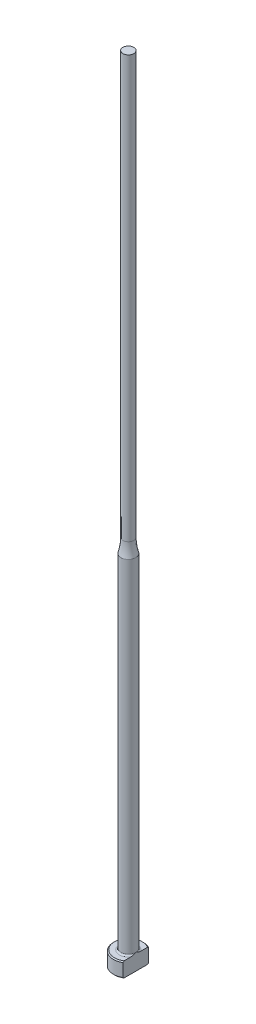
SolidWorks part; units mm, degrees
ref_plane "Front Plane" through (0, 0, 0) normal (0, 0, 1) x (1, 0, 0)
ref_plane "Top Plane" through (0, 0, 0) normal (0, 1, 0) x (1, 0, 0)
ref_plane "Right Plane" through (0, 0, 0) normal (1, 0, 0) x (0, 0, -1)
sketch "Sketch1" plane through (0, 0, 0) normal (0, 0, 1) x (1, 0, 0)
  line L0 (0, 259.9588) -> (0, -15.1925) construction
  line L1 (0, 0) -> (-3, 0)
  line L2 (-3, 0) -> (-3, 3)
  line L3 (-3, 3) -> (-1.5, 3)
  line L4 (-1.1, 75) -> (-1.1, 160)
  line L5 (-1.1, 160) -> (0, 160)
  line L6 (0, 160) -> (0, 0)
  line L7 (-1.5, 3) -> (-1.5, 72.2)
  arc A0 (-1.5, 72.2) -> (-1.1, 75) centre (-11.1, 75) ccw
  point P13 (-1.5, 0)
  dimension "D1" = 10
  dimension "L" = 160
  dimension "H" = 6
  dimension "T" = 3
  dimension "D" = 2.2
  dimension "B" = 3
  dimension "S" = 75
revolve "Revolve1" add sketch "Sketch1" angle 360 about L0
chamfer "Chamfer1" distance 0.2 angle 45 2 edges at (0, 3, 3) (0, 0, 3)
fillet "Fillet1" radius 0.3 1 edges at (0, 3, 1.5)
sketch "Sketch2" plane through (0, 0, 0) normal (0, 1, 0) x (1, 0, 0)
  line L0 (1.5, 2.5981) -> (1.5, -2.5981)
  circle A0 centre (0, 0) radius 3 construction
  arc A1 (1.5, -2.5981) -> (1.5, 2.5981) centre (0, 0) ccw
  circle A2 centre (0, 0) radius 1.5 construction
extrude "KEY" cut sketch "Sketch2" along normal through all
